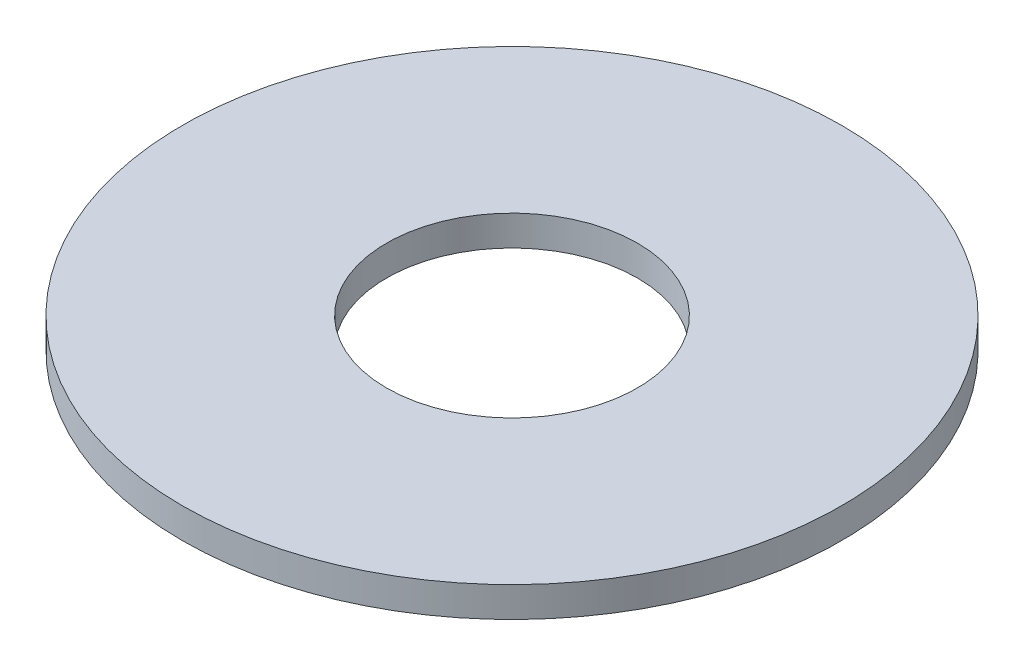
SolidWorks part; units mm, degrees
ref_plane "Plan de face" through (0, 0, 0) normal (0, 0, 1) x (1, 0, 0)
ref_plane "Plan de dessus" through (0, 0, 0) normal (0, 1, 0) x (1, 0, 0)
ref_plane "Plan de droite" through (0, 0, 0) normal (1, 0, 0) x (0, 0, -1)
sketch "Esquisse1" plane through (0, 0, 0) normal (0, 0, 1) x (1, 0, 0)
  line L0 (0, 41.6342) -> (0, -43.693) construction
  line L2 (4.15, 0) -> (10.9, 0)
  line L3 (4.15, 0) -> (4.15, 1)
  line L4 (4.15, 1) -> (10.9, 1)
  line L5 (10.9, 0) -> (10.9, 1)
  dimension "D1" = 1
  dimension "D2" = 8.3
  dimension "D3" = 21.8
revolve "Révolution1" add sketch "Esquisse1" angle 360 about L0
